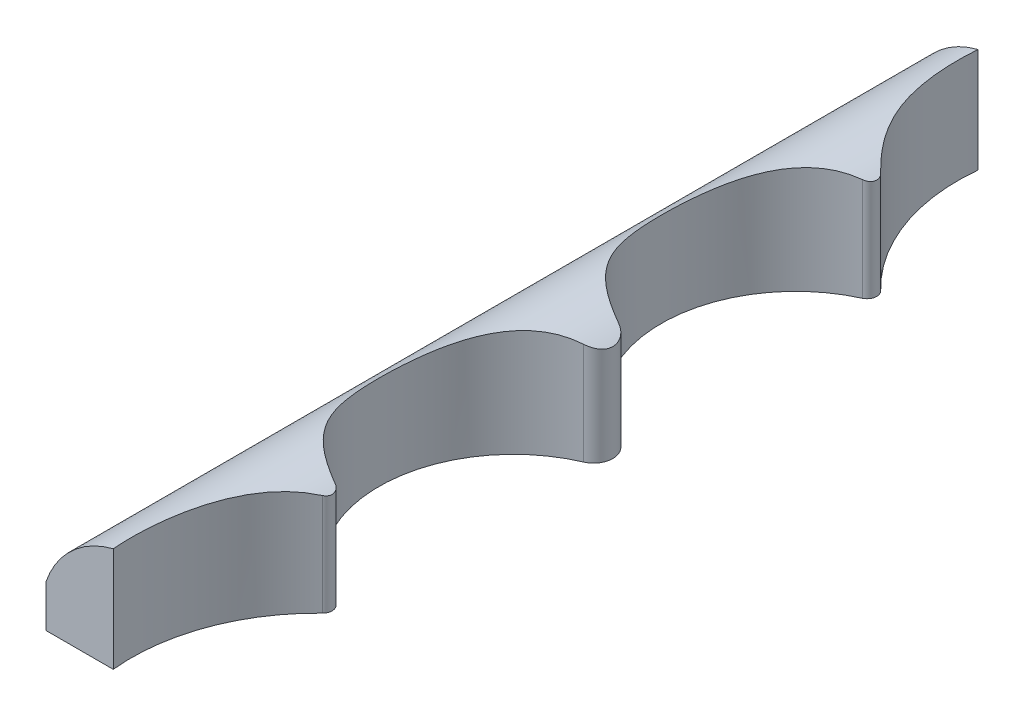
SolidWorks part; units mm, degrees
ref_plane "Alzado" through (0, 0, 0) normal (0, 0, 1) x (1, 0, 0)
ref_plane "Planta" through (0, 0, 0) normal (0, 1, 0) x (1, 0, 0)
ref_plane "Vista lateral" through (0, 0, 0) normal (1, 0, 0) x (0, 0, -1)
sketch "Croquis1" plane through (0, 0, 0) normal (0, 0, 1) x (1, 0, 0)
  line L0 (40, 35) -> (-40, -35) construction
  line L1 (-40, 35) -> (40, 35)
  line L2 (-40, 35) -> (-40, -35)
  line L3 (-40, -35) -> (40, -35)
  line L4 (40, 35) -> (40, -35)
extrude "Extruir1" add sketch "Croquis1" along normal mid plane 470
sketch "Croquis2" plane through (0, 35, 0) normal (0, 1, 0) x (1, 0, 0)
  line L0 (40, -235) -> (40, 235) construction
  line L1 (-40, 235) -> (40, 235)
  line L2 (-40, 235) -> (-40, 225)
  line L3 (-40, 225) -> (40, 225)
  line L4 (40, 235) -> (40, 225)
  line L6 (0, 0) -> (87.3084, 0) construction
  line L7 (40, -235) -> (40, -225)
  line L8 (-40, -225) -> (40, -225)
  line L9 (-40, -235) -> (-40, -225)
  line L10 (-40, -235) -> (40, -235)
  dimension "D1" = 10
extrude "Corte - largo" cut sketch "Croquis2" against normal through all
sketch "Croquis3" plane through (0, 35, 0) normal (0, 1, 0) x (1, 0, 0)
  line L0 (-40, 225) -> (40, 225) construction
  line L1 (0, 0) -> (116.1334, 0) construction
  line L2 (40, -225) -> (40, 225) construction
  line L3 (40, -225) -> (40, 225)
  line L4 (-5, -225) -> (40, -225)
  line L5 (-5, 225) -> (40, 225)
  line L6 (-40, -225) -> (-40, 225) construction
  arc A0 (-5, 225) -> (24.0655, 145.2857) centre (91.5079, 215.0327) ccw
  arc A2 (20, 255) -> (-5, 225) centre (29.8148, 221.4043) ccw construction
  arc A3 (23.963, -9.1812) -> (23.963, 9.1812) centre (20, 0) ccw
  arc A4 (22.6641, 137.1418) -> (23.963, 9.1812) centre (51.7039, 73.4497) ccw
  arc A5 (22.6641, -137.1418) -> (23.963, -9.1812) centre (51.7039, -73.4497) cw
  arc A6 (-5, -225) -> (24.0655, -145.2857) centre (91.5079, -215.0327) cw
  arc A7 (22.6641, -137.1418) -> (24.0655, -145.2857) centre (20.5898, -141.6913) cw
  arc A8 (24.0655, 145.2857) -> (22.6641, 137.1418) centre (20.5898, 141.6913) cw
  point P25 (30, -140)
  point P28 (30, 140)
  dimension "D1" = 140
  dimension "D2" = 10
  dimension "D4" = 60
  dimension "D5" = 70
  dimension "D6" = 5
  dimension "D3" = 70
extrude "Perfilado frontal" cut sketch "Croquis3" against normal through all
sketch "Croquis4" plane through (0, 0, 225) normal (0, 0, 1) x (1, 0, 0)
  line L0 (-5, 35) -> (-40, 35) construction
  line L1 (-40, -35) -> (-40, 35) construction
  line L2 (44.0655, 35) -> (-40, 35)
  line L3 (-40, -13) -> (-40, 35)
  line L7 (44.0655, 35) -> (44.0655, 4.8493)
  line L8 (24.0655, -35) -> (24.0655, 35) construction
  arc A0 (50, -3) -> (-40, -13) centre (7.3426, -29.0835) ccw construction
  arc A1 (44.0655, 4.8493) -> (-40, -13) centre (7.3426, -29.0835) ccw
  dimension "D1" = 20
extrude "Perfilado lateral" cut sketch "Croquis4" against normal through all
